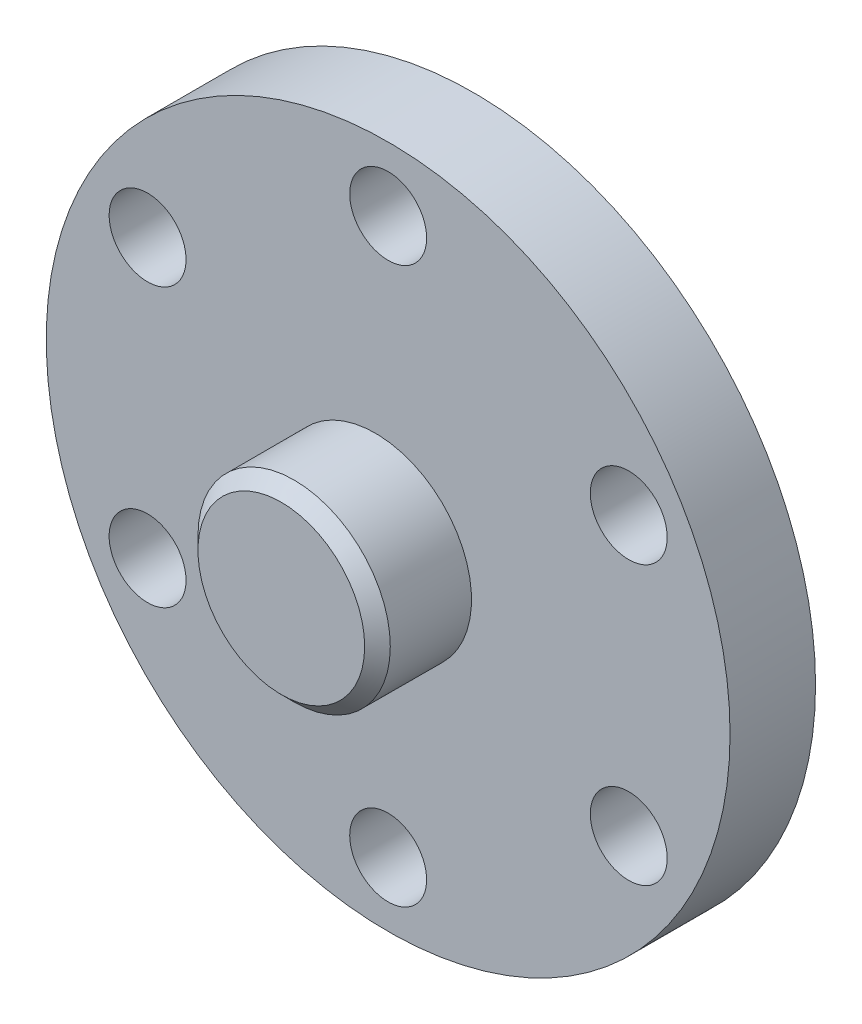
SolidWorks part; units mm, degrees
ref_plane "Front" through (0, 0, 0) normal (0, 0, 1) x (1, 0, 0)
ref_plane "Top" through (0, 0, 0) normal (0, 1, 0) x (1, 0, 0)
ref_plane "Right" through (0, 0, 0) normal (1, 0, 0) x (0, 0, -1)
sketch "Sketch1" plane through (0, 0, 0) normal (0, 0, 1) x (1, 0, 0)
  circle A0 centre (0, 0) radius 80
  dimension "D1" = 160
extrude "Base-Extrude" add sketch "Sketch1" along normal blind 20
sketch "Sketch2" plane through (0, 0, 0) normal (0, 1, 0) x (1, 0, 0)
  line L0 (0, 0) -> (0, -61.8831) construction
  line L1 (0, -20) -> (0, 0) construction
  line L2 (-10, -20) -> (-10, -23)
  line L3 (-80, -20) -> (80, -20) construction
  line L4 (-10, -23) -> (-22.5, -23)
  line L5 (-22.5, -23) -> (-22.5, -45)
  line L6 (-22.5, -45) -> (0, -45)
  line L7 (0, -45) -> (0, -20)
  line L8 (0, -20) -> (-10, -20)
  dimension "D1" = 45
  dimension "D2" = 25
  dimension "D3" = 20
  dimension "D4" = 22
revolve "Boss-Revolve1" add sketch "Sketch2" angle 360 about L0
chamfer "Chamfer1" distance 3 angle 45 1 edges at (-22.5, 0, 45)
sketch "Sketch3" plane through (0, 0, 20) normal (0, 0, 1) x (1, 0, 0)
  circle A0 centre (0, 65) radius 9
  circle A1 centre (0, 0) radius 65 construction
  dimension "D1" = 130
  dimension "D2" = 18
extrude "Cut-Extrude1" cut sketch "Sketch3" against normal through all
pattern_circular "CirPattern1" count 6 over 360 about axis through (0, 0, 0) along (0, 0, 1) of "Cut-Extrude1"
